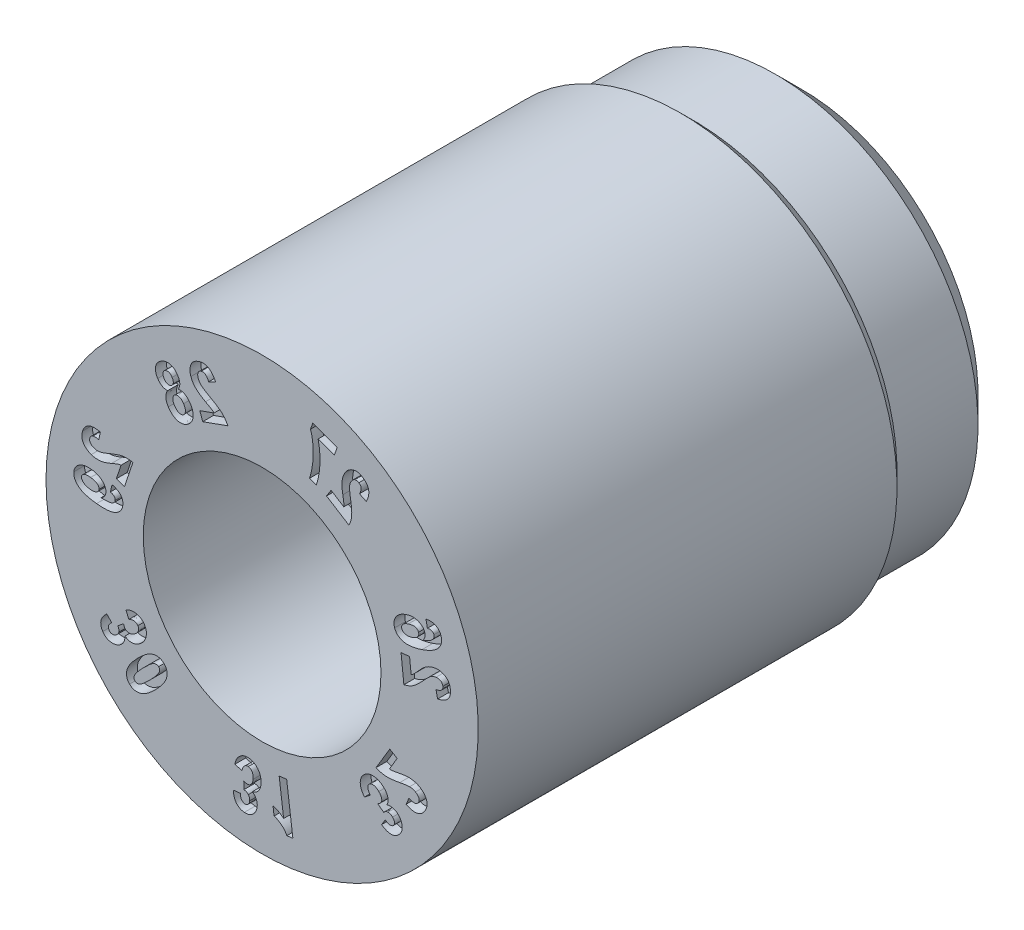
SolidWorks part; units mm, degrees
ref_plane "Front Plane" through (0, 0, 0) normal (0, 0, 1) x (1, 0, 0)
ref_plane "Top Plane" through (0, 0, 0) normal (0, 1, 0) x (1, 0, 0)
ref_plane "Right Plane" through (0, 0, 0) normal (1, 0, 0) x (0, 0, -1)
sketch "Sketch2" plane through (0, 0, 0) normal (0, 1, 0) x (1, 0, 0)
  line L0 (0, 4.8491) -> (0, -49995.1509) construction
  line L10 (3.2496, 10) -> (1.15, 10)
  line L11 (3.75, 9.4996) -> (3.2496, 10)
  line L12 (3.75, 8) -> (3.75, 9.4996)
  line L13 (4, 7.75) -> (3.75, 8)
  line L14 (4, 0) -> (4, 7.75)
  line L15 (2.2, 0) -> (4, 0)
  line L16 (2.2, 0) -> (2.2, 7.468)
  line L17 (1.15, 7.468) -> (2.2, 7.468)
  line L18 (1.15, 7.468) -> (1.15, 10)
  dimension "D1" = 8
  dimension "D2" = 4.4
  dimension "D3" = 2.532
  dimension "D4" = 2.3
  dimension "D5" = 7.5
  dimension "D6" = 10
  dimension "D7" = 45
  dimension "D8" = 45
  dimension "D9" = 2
  dimension "D10" = 0.5004
revolve "Revolve1" add sketch "Sketch2" angle 360 about L0
sketch "Sketch8" plane through (0, 0, 0) normal (0, 0, 1) x (1, 0, 0)
  line L0 (0, 0) -> (0, 4) construction
  line L1 (0, 0) -> (3.1273, 2.494) construction
  line L2 (0, 0) -> (3.8997, -0.8901) construction
  line L3 (0, 0) -> (1.7355, -3.6039) construction
  line L4 (0, 0) -> (-1.7355, -3.6039) construction
  line L5 (0, 0) -> (-3.8997, -0.8901) construction
  line L6 (0, 0) -> (-3.1273, 2.494) construction
  circle A0 centre (0, 0) radius 4 construction
  circle A30 centre (0, 0) radius 2.6264 construction
  text T0 "26    27    28    29    30    31    32" font "Arial Narrow" height 0.89
  point P12 (0, 0)
  dimension "D1" = 7
extrude "Cut-Extrude2" cut sketch "Sketch8" against normal blind 0.2
